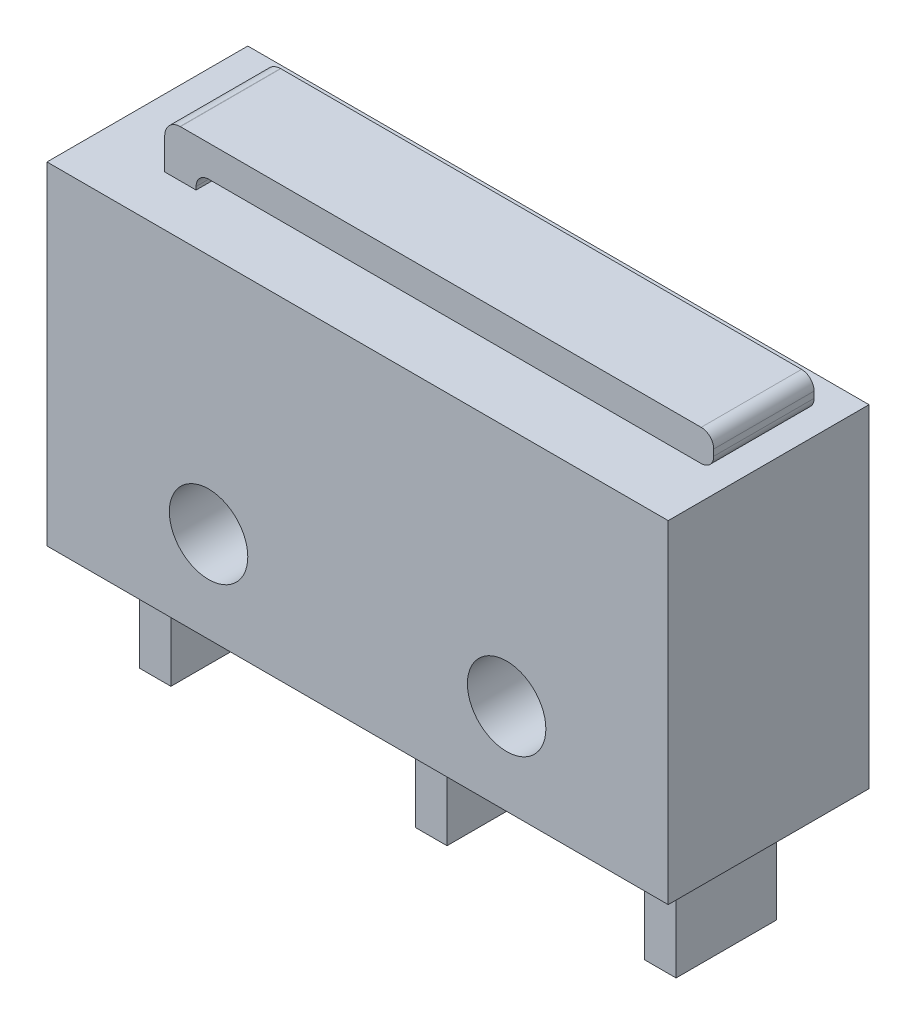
SolidWorks part; units mm, degrees
ref_plane "Plan de face" through (0, 0, 0) normal (0, 0, 1) x (1, 0, 0)
ref_plane "Plan de dessus" through (0, 0, 0) normal (0, 1, 0) x (1, 0, 0)
ref_plane "Plan de droite" through (0, 0, 0) normal (1, 0, 0) x (0, 0, -1)
sketch "Esquisse1" plane through (0, 0, 0) normal (0, 1, 0) x (1, 0, 0)
  line L1 (-9.9, 3.2) -> (9.9, 3.2)
  line L2 (-9.9, 3.2) -> (-9.9, -3.2)
  line L3 (-9.9, -3.2) -> (9.9, -3.2)
  line L4 (9.9, 3.2) -> (9.9, -3.2)
  line L5 (-9.9, 3.2) -> (9.9, -3.2) construction
  line L6 (-9.9, -3.2) -> (9.9, 3.2) construction
  point P0 (0, 0)
  dimension "D1" = 19.8
  dimension "D2" = 6.4
extrude "Boss.-Extru.1" add sketch "Esquisse1" along normal blind 10.6
sketch "Esquisse2" plane through (0, 0, 0) normal (0, 0, 1) x (1, 0, 0)
  line L0 (-9.9, 0) -> (9.9, 0) construction
  line L1 (-8.55, 0) -> (-7.55, 0)
  line L2 (-8.55, 0) -> (-8.55, -3.5)
  line L3 (-8.55, -3.5) -> (-7.55, -3.5)
  line L4 (-7.55, 0) -> (-7.55, -3.5)
  line L5 (0.25, 0) -> (1.25, 0)
  line L6 (0.25, 0) -> (0.25, -3.5)
  line L7 (0.25, -3.5) -> (1.25, -3.5)
  line L8 (1.25, 0) -> (1.25, -3.5)
  line L9 (-9.9, 2.9) -> (9.9, 2.9) construction
  line L10 (7.55, 0) -> (8.55, 0)
  line L11 (7.55, 0) -> (7.55, -3.5)
  line L12 (7.55, -3.5) -> (8.55, -3.5)
  line L13 (8.55, 0) -> (8.55, -3.5)
  line L14 (-8.05, -3.5) -> (-8.05, -5.329) construction
  line L15 (0.75, -3.5) -> (0.75, -4.8904) construction
  line L16 (8.05, -3.5) -> (8.05, -4.8904) construction
  line L17 (-9.9, 10.6) -> (-9.9, 0) construction
  line L18 (9.9, 10.6) -> (9.9, 0) construction
  point P22 (-9.9, 2.9)
  point P27 (0, 2.9)
  point P29 (0, 0)
  dimension "D2" = 1.85
  dimension "D4" = 1
  dimension "D5" = 2.9
  dimension "D6" = 6.4
  dimension "D1" = 2
  dimension "D3" = 2
extrude "Boss.-Extru.2" add sketch "Esquisse2" along normal mid plane 3.2
sketch "Esquisse3" plane through (0, 0, 0) normal (0, 0, 1) x (1, 0, 0)
  line L0 (-9.9, 2.9) -> (9.9, 2.9) construction
  line L1 (-9.9, 10.6) -> (-9.9, 0) construction
  line L2 (9.9, 10.6) -> (9.9, 0) construction
  line L3 (-9.9, 0) -> (9.9, 0) construction
  line L4 (0, 2.9) -> (0, 4.6614) construction
  circle A0 centre (-4.75, 2.9) radius 1.25
  circle A1 centre (4.75, 2.9) radius 1.25
  point P8 (0, 2.9)
  point P9 (-4.75, 2.9)
  point P17 (4.75, 2.9)
  dimension "D3" = 2.5
  dimension "D1" = 2.9
  dimension "D2" = 4.75
extrude "Enlèv. mat.-Extru.1" cut sketch "Esquisse3" against normal mid plane 10 contours A0 | A1
sketch "Esquisse4" plane through (0, 0, 0) normal (0, 0, 1) x (1, 0, 0)
  line L0 (-4.75, 2.9) -> (-4.75, 11.7003) construction
  line L1 (9.75, 5.6515) -> (9.75, 12.5283) construction
  line L2 (-7.2473, 10.6) -> (-7.2473, 11.6) construction
  line L3 (-9.9, 10.6) -> (9.9, 10.6) construction
  line L4 (-7.2473, 11.6) -> (9.75, 11.6) construction
  line L5 (-6.7473, 10.6) -> (-6.7473, 10.7)
  line L6 (-7.7473, 10.6) -> (-7.7473, 12.0884) construction
  line L7 (-7.7473, 10.6) -> (-7.7473, 11.5999)
  line L8 (-7.2473, 12.1) -> (9.35, 12.1)
  line L9 (-6.7473, 10.6) -> (-6.7473, 12.0884) construction
  line L10 (-7.2473, 12.1) -> (-7.2589, 12.0997)
  line L11 (-6.3473, 11.1) -> (9.35, 11.1)
  line L12 (-7.2473, 10.6) -> (-7.2473, 12.0884) construction
  line L13 (9.75, 11.7) -> (9.75, 11.5)
  line L14 (-7.2473, 12.1) -> (9.75, 12.1) construction
  line L15 (-7.7473, 10.6) -> (-6.7473, 10.6)
  arc A2 (-7.7473, 11.5999) -> (-7.2589, 12.0997) centre (-7.2473, 11.5999) cw
  arc A3 (-6.3473, 11.1) -> (-6.7473, 10.7) centre (-6.3473, 10.7) ccw
  arc A4 (9.35, 12.1) -> (9.75, 11.7) centre (9.35, 11.7) cw
  arc A5 (9.75, 11.5) -> (9.35, 11.1) centre (9.35, 11.5) cw
  point P5 (-7.2473, 11.6)
  dimension "D5" = 0.5
  dimension "D6" = 0.4
  dimension "D7" = 0.4
  dimension "D8" = 0.4
  dimension "D1" = 14.5
  dimension "D2" = 1
  dimension "D3" = 0.5
  dimension "D4" = 0.5
extrude "Boss.-Extru.3" add sketch "Esquisse4" along normal mid plane 3.2
